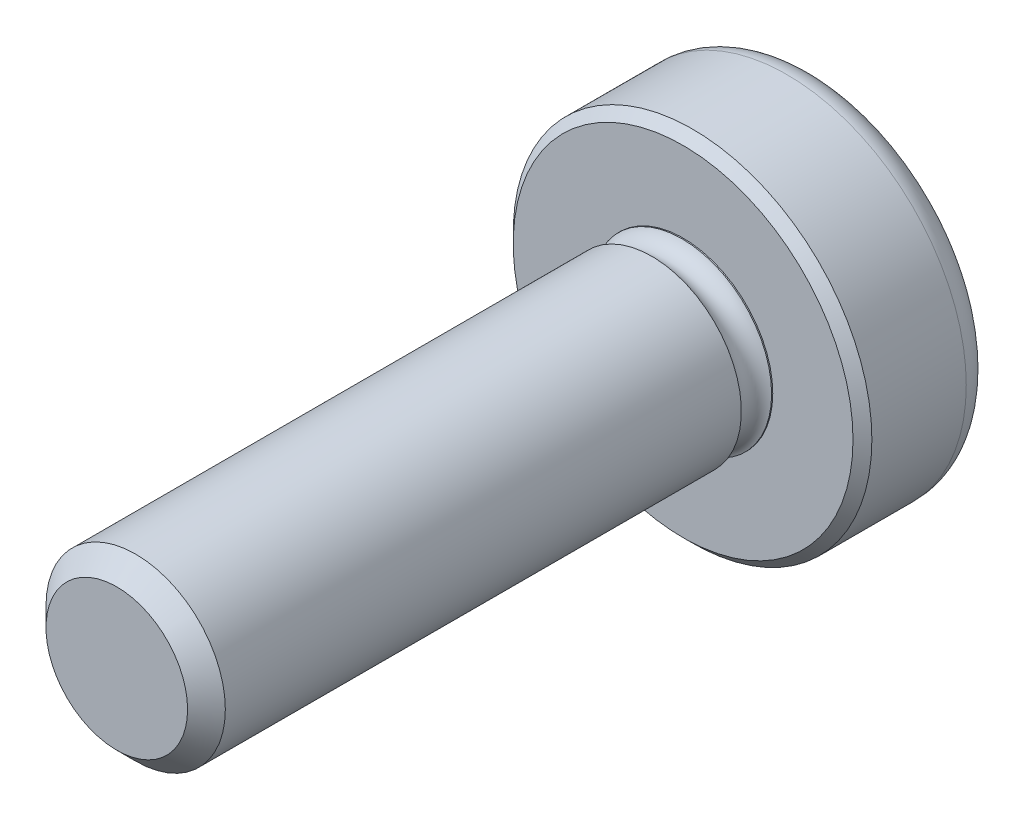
SolidWorks part; units mm, degrees
ref_plane "Plane1" through (0, 0, 0) normal (0, 0, 1) x (1, 0, 0)
ref_plane "Plane2" through (0, 0, 0) normal (0, 1, 0) x (1, 0, 0)
ref_plane "Plane3" through (0, 0, 0) normal (1, 0, 0) x (0, 0, -1)
sketch "Sketch1" plane through (0, 0, 0) normal (0, 0, 1) x (1, 0, 0)
  circle A0 centre (0, 0) radius 1.9
  dimension "D1" = 3.8
extrude "Base-Extrude" add sketch "Sketch1" along normal blind 1.4
sketch "Sketch2" plane through (0, 0, 1.4) normal (0, 0, 1) x (1, 0, 0)
  circle A0 centre (0, 0) radius 0.95
  dimension "D1" = 1.9
extrude "Boss-Extrude1" add sketch "Sketch2" along normal blind 6
chamfer "Chamfer1" distance 0.2 angle 45 1 edges at (0.95, 0, 7.4)
chamfer "Chamfer2" distance 0.1 angle 45 1 edges at (1.9, 0, 1.4)
fillet "Fillet1" radius 0.3 1 edges at (1.9, 0, 0)
sketch "Sketch3" plane through (0, 0, 0) normal (0, 0, -1) x (-1, 0, 0)
  line L0 (1.3671, 0.2642) -> (1.3671, -0.2642)
  line L1 (-0.2472, 1.3717) -> (0.2472, 1.3717)
  line L2 (-0.2472, 1.3717) -> (-0.2472, 0.2642)
  line L3 (-0.2472, -1.3731) -> (0.2472, -1.3731)
  line L4 (0.2472, 1.3717) -> (0.2472, 0.2642)
  line L5 (1.3671, 0.2642) -> (0.2472, 0.2642)
  line L6 (-1.3708, 0.2642) -> (-1.3708, -0.2642)
  line L7 (1.3671, -0.2642) -> (0.2472, -0.2642)
  line L8 (0.2472, -0.2642) -> (0.2472, -1.3731)
  line L9 (-0.2472, -0.2642) -> (-1.3708, -0.2642)
  line L10 (-0.2472, -0.2642) -> (-0.2472, -1.3731)
  line L11 (-0.2472, 0.2642) -> (-1.3708, 0.2642)
  circle A0 centre (0, 0) radius 0.3618 construction
  dimension "D1" = 90
  dimension "D2" = 90
  dimension "D3" = 90
  dimension "D4" = 90
extrude "Cut-Extrude1" cut sketch "Sketch3" against normal blind 0.5 draft 10
sketch "Sketch4" plane through (0, 0, 0) normal (0, 1, 0) x (1, 0, 0)
  line L0 (0, 0) -> (0, -2.1594) construction
  circle A0 centre (1.0129, -1.5726) radius 0.1722
revolve "Cut-Revolve1" cut sketch "Sketch4" angle 360 about L0
